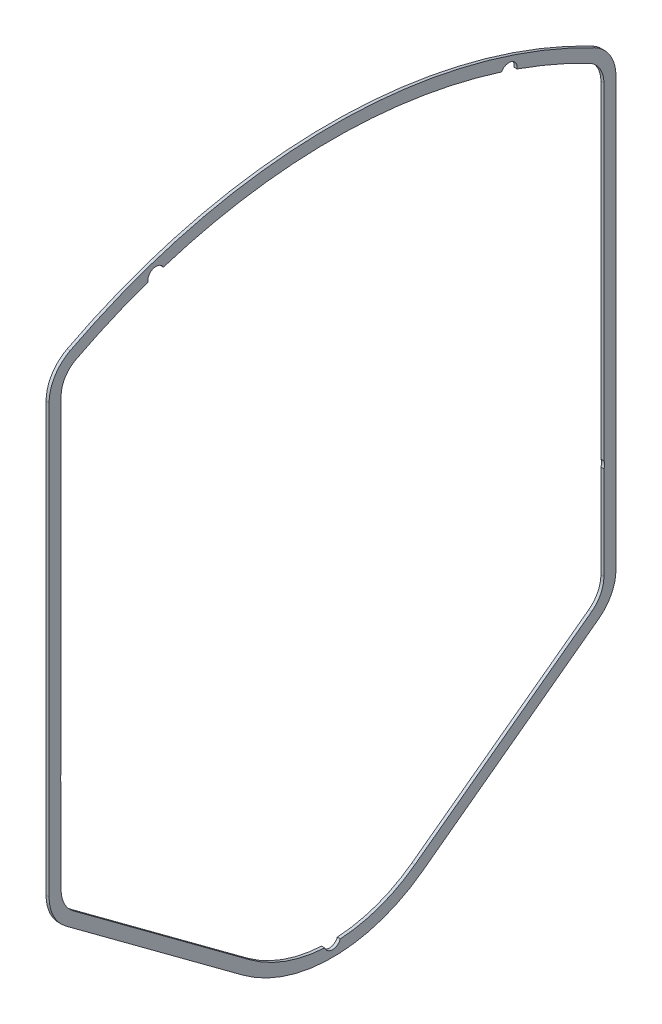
SolidWorks part; units mm, degrees
ref_plane "Face" through (0, 0, 0) normal (0, 0, 1) x (1, 0, 0)
ref_plane "Dessus" through (0, 0, 0) normal (0, 1, 0) x (1, 0, 0)
ref_plane "Droite" through (0, 0, 0) normal (1, 0, 0) x (0, 0, -1)
sketch "Esquisse2" plane through (0, 0, 0) normal (1, 0, 0) x (0, 0, -1)
  line L0 (0, -309.6793) -> (0, 126.5) construction
  line L1 (94, 14.4128) -> (94, 156.253)
  line L2 (27.3618, -36.9774) -> (85.9482, 6.3742)
  line L3 (29.7411, -40.1928) -> (88.3275, 3.1588)
  line L4 (90, 14.4128) -> (90, 45.3544)
  line L5 (-29.7411, -40.1928) -> (-88.3275, 3.1588)
  line L6 (-90, 14.4128) -> (-90, 45.3544)
  line L7 (-94, 14.4128) -> (-94, 156.253)
  line L8 (-27.3618, -36.9774) -> (-85.9482, 6.3742)
  line L9 (-90, 47.6456) -> (-90, 156.253)
  line L10 (90, 47.6456) -> (90, 156.253)
  arc A0 (-27.3618, -36.9774) -> (-2.589, -45.9271) centre (0, 0) ccw
  arc A1 (86.983, 167.7944) -> (-86.983, 167.7944) centre (0, 0) ccw
  arc A2 (85.9482, 6.3742) -> (90, 14.4128) centre (80, 14.4128) ccw
  arc A3 (94, 156.253) -> (86.983, 167.7944) centre (81, 156.253) ccw
  arc A4 (90, 156.253) -> (85.142, 164.2432) centre (81, 156.253) ccw
  arc A5 (88.3275, 3.1588) -> (94, 14.4128) centre (80, 14.4128) ccw
  arc A6 (85.142, 164.2432) -> (61.2174, 174.5779) centre (0, 0) ccw
  arc A7 (-29.7411, -40.1928) -> (29.7411, -40.1928) centre (0, 0) ccw
  arc A8 (-85.142, 164.2432) -> (-90, 156.253) centre (-81, 156.253) ccw
  arc A9 (-94, 14.4128) -> (-88.3275, 3.1588) centre (-80, 14.4128) ccw
  arc A10 (-90, 14.4128) -> (-85.9482, 6.3742) centre (-80, 14.4128) ccw
  arc A11 (-86.983, 167.7944) -> (-94, 156.253) centre (-81, 156.253) ccw
  arc A12 (-61.2174, 174.5779) -> (-85.142, 164.2432) centre (0, 0) ccw
  arc A13 (-56.075, 176.2969) -> (-61.2174, 174.5779) centre (-58.5, 175) ccw
  arc A14 (56.075, 176.2969) -> (-56.075, 176.2969) centre (0, 0) ccw
  arc A15 (61.2174, 174.5779) -> (56.075, 176.2969) centre (58.5, 175) ccw
  arc A16 (90, 47.6456) -> (90, 45.3544) centre (87.5, 46.5) cw
  arc A17 (-2.589, -45.9271) -> (2.589, -45.9271) centre (0, -45) ccw
  arc A18 (2.589, -45.9271) -> (27.3618, -36.9774) centre (0, 0) ccw
  arc A19 (-90, 47.6456) -> (-90, 45.3544) centre (-87.5, 46.5) ccw
  dimension "D1" = 189
  dimension "D2" = 50
  dimension "D5" = 14
  dimension "D6" = 13
  dimension "D7" = 5.5
  dimension "D8" = 5.5
  dimension "D12" = 5.5
  dimension "D13" = 14
  dimension "D17" = 2.75
  dimension "D3" = 188
  dimension "D4" = 107
  dimension "D9" = 117
  dimension "D10" = 46.5
  dimension "D11" = 87.5
  dimension "D14" = 175
  dimension "D15" = 45
  dimension "D16" = 4
extrude "Base-Extrusion" add sketch "Esquisse2" along normal blind 1
